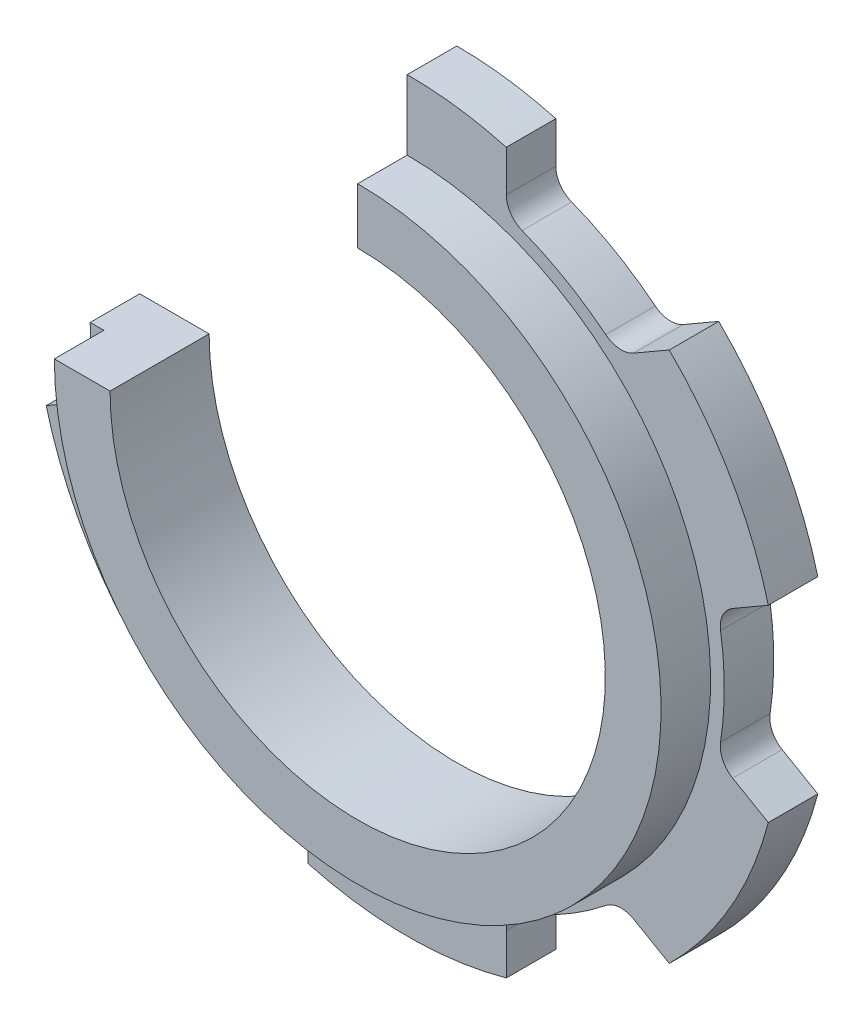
SolidWorks part; units mm, degrees
ref_plane "Plan de face" through (0, 0, 0) normal (0, 0, 1) x (1, 0, 0)
ref_plane "Plan de dessus" through (0, 0, 0) normal (0, 1, 0) x (1, 0, 0)
ref_plane "Plan de droite" through (0, 0, 0) normal (1, 0, 0) x (0, 0, -1)
sketch "Esquisse1" plane through (0, 0, 0) normal (0, 0, 1) x (1, 0, 0)
  circle A0 centre (0, 0) radius 10
  circle A1 centre (0, 0) radius 12.25
  dimension "D1" = 24.5
  dimension "D2" = 20
extrude "Extrusion1" add sketch "Esquisse1" along normal blind 2
sketch "Esquisse2" plane through (0, 0, 0) normal (0, 0, -1) x (-1, 0, 0)
  line L0 (0, 0) -> (0, 16.2679) construction
  line L2 (0, 0) -> (-4.3831, 15.9171) construction
  line L3 (4, 14.5259) -> (4, 12.1614)
  line L4 (-4, 14.5259) -> (-4, 12.1614)
  line L5 (10.5798, 10.7271) -> (8.5321, 9.5448)
  line L6 (14.5798, 3.7989) -> (12.5321, 2.6166)
  line L7 (14.5798, -3.7989) -> (12.5321, -2.6166)
  line L8 (10.5798, -10.7271) -> (8.5321, -9.5448)
  line L9 (4, -14.5259) -> (4, -12.1614)
  line L10 (-4, -14.5259) -> (-4, -12.1614)
  line L11 (-10.5798, -10.7271) -> (-8.5321, -9.5448)
  line L12 (-14.5798, -3.7989) -> (-12.5321, -2.6166)
  line L13 (-14.5798, 3.7989) -> (-12.5321, 2.6166)
  line L14 (-10.5798, 10.7271) -> (-8.5321, 9.5448)
  arc A0 (4, 14.5259) -> (-4, 14.5259) centre (0, 0) ccw
  circle A1 centre (0, 0) radius 10
  arc A2 (4, -12.1614) -> (8.5321, -9.5448) centre (0, 0) ccw
  arc A4 (11.655, 3.7715) -> (9.0937, 8.2078) centre (0, 0) ccw
  arc A5 (8.5321, 9.5448) -> (4, 12.1614) centre (0, 0) ccw
  arc A6 (14.5798, 3.7989) -> (10.5798, 10.7271) centre (0, 0) ccw
  arc A7 (12.5321, -2.6166) -> (12.5321, 2.6166) centre (0, 0) ccw
  arc A8 (10.5798, -10.7271) -> (14.5798, -3.7989) centre (0, 0) ccw
  arc A9 (-11.655, -3.7715) -> (-9.0937, -8.2078) centre (0, 0) ccw
  arc A10 (-4, -14.5259) -> (4, -14.5259) centre (0, 0) ccw
  arc A11 (-8.5321, -9.5448) -> (-4, -12.1614) centre (0, 0) ccw
  arc A12 (-14.5798, -3.7989) -> (-10.5798, -10.7271) centre (0, 0) ccw
  arc A14 (-10.5798, 10.7271) -> (-14.5798, 3.7989) centre (0, 0) ccw
  arc A15 (2.5613, 11.9792) -> (2.1272, 12.0639) centre (0, 0) ccw
  arc A16 (-4, 12.1614) -> (-8.5321, 9.5448) centre (0, 0) ccw
  arc A17 (9.0937, -8.2078) -> (11.655, -3.7715) centre (0, 0) ccw
  arc A18 (-2.5613, -11.9792) -> (2.5613, -11.9792) centre (0, 0) ccw
  arc A19 (-12.5321, 2.6166) -> (-12.5321, -2.6166) centre (0, 0) ccw
  arc A20 (-9.0937, 8.2078) -> (-11.655, 3.7715) centre (0, 0) ccw
  dimension "D1" = 4
extrude "Extrusion2" add sketch "Esquisse2" along normal blind 2
fillet "Congé1" radius 1 12 edges at (4, 12.1614, -1) (12.5321, 2.6166, -1) (4, -12.1614, -1) (8.5321, -9.5448, -1) (-8.5321, -9.5448, -1) (-4, -12.1614, -1) (-12.5321, 2.6166, -1) (-12.5321, -2.6166, -1) (-4, 12.1614, -1) (12.5321, -2.6166, -1) (8.5321, 9.5448, -1) (-8.5321, 9.5448, -1)
sketch "Esquisse5" plane through (0, 0, 0) normal (1, 0, 0) x (0, 0, -1)
  line L1 (-11.5325, 0) -> (9.7344, 0)
  line L2 (-11.5325, 0) -> (-11.5325, 25.058)
  line L3 (-11.5325, 25.058) -> (9.7344, 25.058)
  line L4 (9.7344, 0) -> (9.7344, 25.058)
extrude "Enlèv. mat.-Extru.1" cut sketch "Esquisse5" against normal through all
